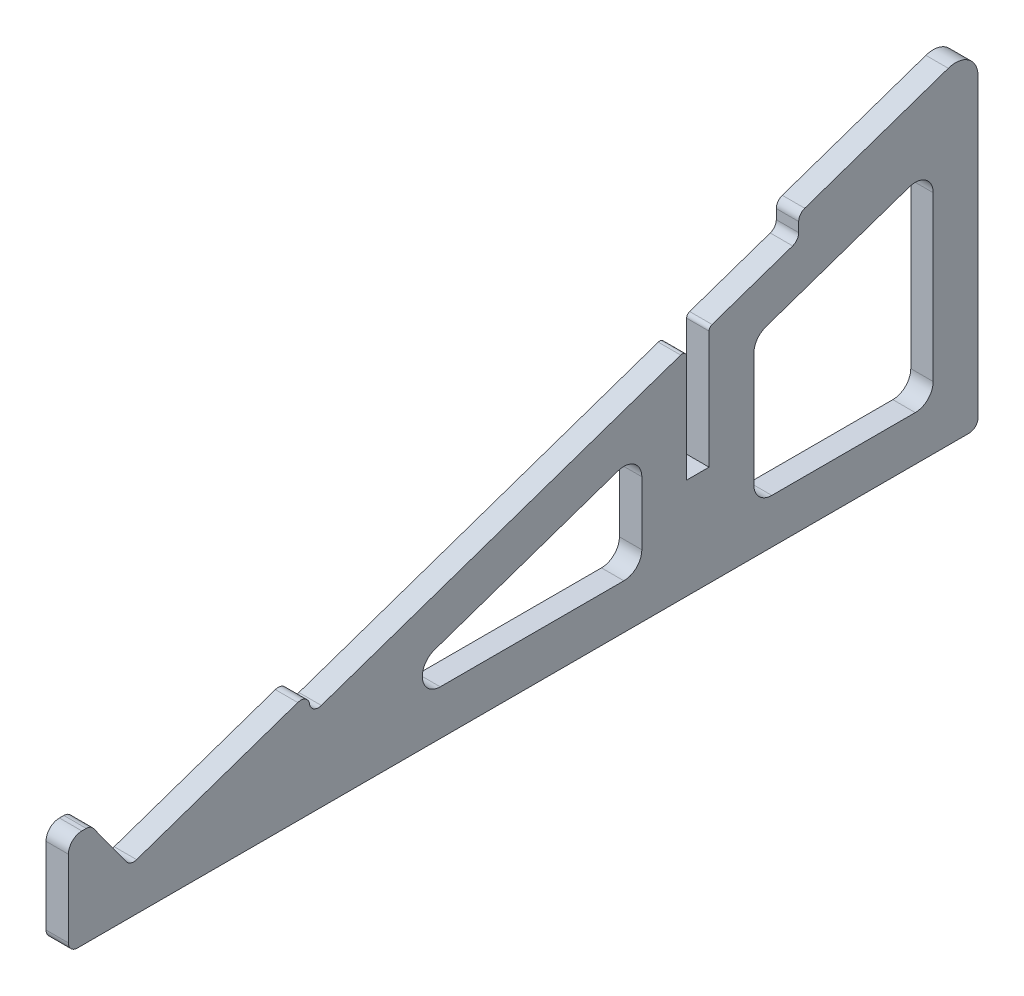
SolidWorks part; units mm, degrees
ref_plane "Front Plane" through (0, 0, 0) normal (0, 0, 1) x (1, 0, 0)
ref_plane "Top Plane" through (0, 0, 0) normal (0, 1, 0) x (1, 0, 0)
ref_plane "Right Plane" through (0, 0, 0) normal (1, 0, 0) x (0, 0, -1)
sketch "Sketch1" plane through (0, 0, 0) normal (1, 0, 0) x (0, 0, -1)
  line L0 (-128.8545, 0) -> (128.8545, 0)
  line L1 (128.8545, 0) -> (128.8545, 95.3943)
  line L2 (128.8545, 95.3943) -> (-111.3072, 12.7)
  line L3 (-111.3072, 12.7) -> (-122.5045, 28.1118)
  line L4 (-122.5045, 28.1118) -> (-128.8545, 28.1118)
  line L5 (-128.8545, 0) -> (-128.8545, 28.1118)
  point P3 (0, 0)
  dimension "D1" = 254
  dimension "D2" = 19
  dimension "D3" = 6.35
  dimension "D4" = 19.05
  dimension "D5" = 12.7
  dimension "D6" = 107
extrude "Main Body" add sketch "Sketch1" along normal blind 6.35
sketch "Sketch2" plane through (6.35, 0, 0) normal (1, 0, 0) x (0, 0, -1)
  line L0 (78.0545, 77.9025) -> (78.0545, 71.5525)
  line L1 (128.8545, 95.3943) -> (-111.3072, 12.7) construction
  line L2 (78.0545, 71.5525) -> (-60.5072, 23.8418)
  line L3 (-60.5072, 30.1918) -> (78.0545, 77.9025)
  line L4 (128.8545, 0) -> (128.8545, 95.3943) construction
  line L5 (-60.5072, 23.8418) -> (-60.5072, 30.1918)
  dimension "D1" = 50.8
  dimension "D2" = 6.35
  dimension "D3" = 50.8
extrude "Lip Cut" cut sketch "Sketch2" against normal through all
fillet "Fillet1" radius 2.54 2 edges at (3.175, 77.9025, -78.0545) (3.175, 30.1918, 60.5072)
fillet "Fillet2" radius 2.54 6 edges at (3.175, 12.7, 111.3072) (3.175, 71.5525, -78.0545) (3.175, 23.8418, 60.5072) (3.175, 28.1118, 122.5045) (3.175, 0, -128.8545) (3.175, 0, 128.8545)
fillet "Fillet3" radius 3.81 1 edges at (3.175, 28.1118, 128.8545)
fillet "Fillet4" radius 6.35 1 edges at (3.175, 95.3943, -128.8545)
sketch "Sketch3" plane through (6.35, 0, 0) normal (1, 0, 0) x (0, 0, -1)
  line L0 (52.6545, 62.8065) -> (52.6545, 28.5165)
  line L1 (-57.1963, 24.9819) -> (76.3415, 70.9626) construction
  line L2 (52.6545, 28.5165) -> (46.3045, 28.5165)
  line L3 (46.3045, 28.5165) -> (46.3045, 60.6201)
  line L4 (46.3045, 60.6201) -> (52.6545, 62.8065)
  line L5 (128.8545, 2.54) -> (128.8545, 86.4919) construction
  dimension "D1" = 76.2
  dimension "D2" = 6.35
  dimension "D3" = 34.29
extrude "Notch Cut" cut sketch "Sketch3" against normal through all
sketch "Sketch4" plane through (6.35, 0, 0) normal (1, 0, 0) x (0, 0, -1)
  line L0 (65.3545, 53.7477) -> (65.3545, 12.7)
  line L1 (65.3545, 12.7) -> (116.1545, 12.7)
  line L2 (116.1545, 12.7) -> (116.1545, 71.2396)
  line L3 (116.1545, 71.2396) -> (65.3545, 53.7477)
  line L4 (52.6545, 62.8065) -> (76.3415, 70.9626) construction
  line L5 (33.6045, 42.8153) -> (33.6045, 12.7)
  line L6 (33.6045, 12.7) -> (-53.8567, 12.7)
  line L7 (-53.8567, 12.7) -> (33.6045, 42.8153)
  line L8 (128.8545, 2.54) -> (128.8545, 86.4919) construction
  line L9 (116.1545, 12.7) -> (128.8545, 12.7) construction
  line L10 (116.1545, 12.7) -> (116.1545, 0) construction
  line L11 (-126.3145, 0) -> (126.3145, 0) construction
  line L12 (64.498, 66.8846) -> (68.6327, 54.8765) construction
  line L14 (52.6545, 28.5165) -> (65.3545, 28.5165) construction
  line L15 (52.6545, 28.5165) -> (52.6545, 62.8065) construction
  line L16 (46.3045, 28.5165) -> (33.6045, 28.5165) construction
  line L17 (46.3045, 60.6201) -> (46.3045, 28.5165) construction
  line L18 (46.3045, 28.5165) -> (52.6545, 28.5165) construction
  point P27 (64.498, 66.8846)
  dimension "D1" = 12.7
extrude "Weight Cut" cut sketch "Sketch4" against normal through all
fillet "Fillet5" radius 5.08 7 edges at (3.175, 12.7, -116.1545) (3.175, 12.7, -33.6045) (3.175, 12.7, -65.3545) (3.175, 12.7, 53.8567) (3.175, 71.2396, -116.1545) (3.175, 42.8153, -33.6045) (3.175, 53.7477, -65.3545)
fillet "Fillet6" radius 1.27 2 edges at (3.175, 62.8065, -52.6545) (3.175, 60.6201, -46.3045)
